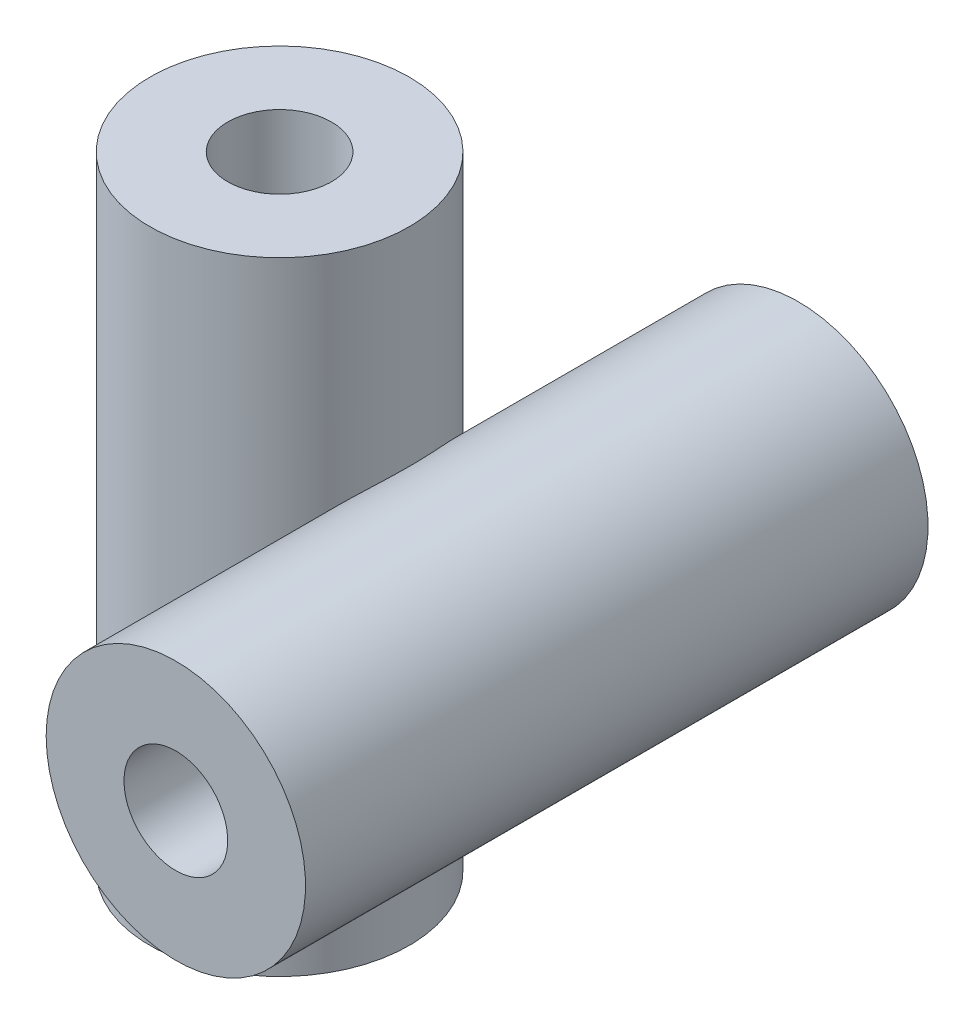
SolidWorks part; units mm, degrees
ref_plane "Front Plane" through (0, 0, 0) normal (0, 0, 1) x (1, 0, 0)
ref_plane "Top Plane" through (0, 0, 0) normal (0, 1, 0) x (1, 0, 0)
ref_plane "Right Plane" through (0, 0, 0) normal (1, 0, 0) x (0, 0, -1)
ref_plane "Plane1" through (0, 0, 0) normal (0, -1, 0) x (1, 0, 0)
sketch "Sketch1" plane through (0, 0, 0) normal (0, -1, 0) x (1, 0, 0)
  line L0 (21.25, 15) -> (15, 15)
  line L1 (15, 15) -> (15, -15)
  line L2 (15, -15) -> (21.25, -15)
  line L3 (21.25, -15) -> (21.25, 15)
  line L4 (15, 15.0021) -> (15, -15.0021) construction
revolve "Revolve1" add sketch "Sketch1" angle 360 about L4
ref_plane "Plane2" through (5, 0, 0) normal (1, 0, 0) x (0, 0, -1)
sketch "Sketch2" plane through (5, 0, 0) normal (1, 0, 0) x (0, 0, -1)
  line L0 (0, -15) -> (6.25, -15)
  line L1 (6.25, -15) -> (6.25, 15)
  line L2 (6.25, 15) -> (0, 15)
  line L3 (0, 15) -> (0, -15)
  line L4 (0, 15) -> (0, -15) construction
revolve "Revolve2" add sketch "Sketch2" angle 360 about L4
hole_wizard "Ø5.0 (5) Diameter Hole1" positions "Sketch4" profile "Sketch3" hole size "Ø5.0" standard "ANSI Metric"
sketch "Sketch4" plane through (0, -15, 0) normal (0, -1, 0) x (-1, 0, 0)
  point P0 (-5, 0)
sketch "Sketch3" plane through (5, -15, 0) normal (1, 0, 0) x (0, 0, -1)
  line L0 (0, 0) -> (0, 30)
  line L1 (0, 30) -> (2.5, 30)
  line L2 (2.5, 30) -> (2.5, 0)
  line L5 (2.5, 0) -> (0, 0)
  line L11 (0, -6.35) -> (0, 107.95) construction
  dimension "Thru Hole Dia." = 5
  dimension "Thru Hole Depth" = 30
hole_wizard "Ø5.0 (5) Diameter Hole2" positions "Sketch6" profile "Sketch5" hole size "Ø5.0" standard "ANSI Metric"
sketch "Sketch6" plane through (0, 0, -15) normal (0, 0, -1) x (-1, 0, 0)
  point P0 (-15, 0)
sketch "Sketch5" plane through (15, 0, -15) normal (1, 0, 0) x (0, 1, 0)
  line L0 (0, 0) -> (0, 30)
  line L1 (0, 30) -> (2.5, 30)
  line L2 (2.5, 30) -> (2.5, 0)
  line L5 (2.5, 0) -> (0, 0)
  line L11 (0, -6.35) -> (0, 107.95) construction
  dimension "Thru Hole Dia." = 5
  dimension "Thru Hole Depth" = 30
